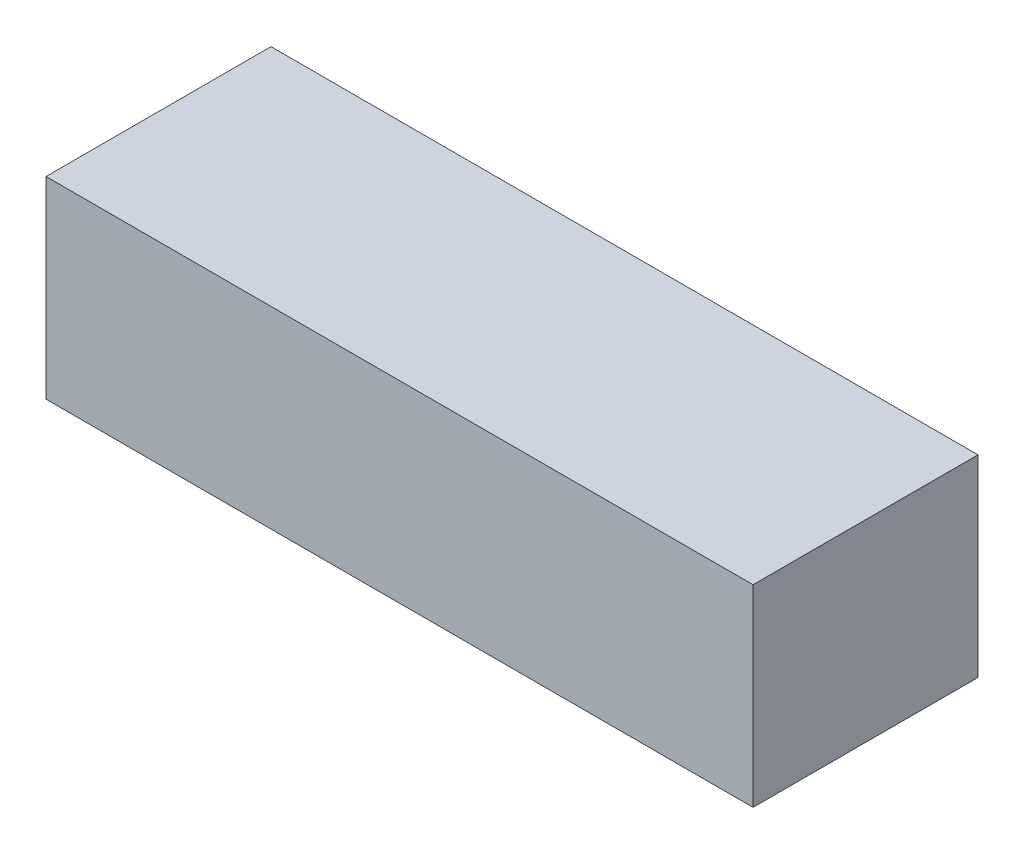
SolidWorks part; units mm, degrees
ref_plane "Front Plane" through (0, 0, 0) normal (0, 0, 1) x (1, 0, 0)
ref_plane "Top Plane" through (0, 0, 0) normal (0, 1, 0) x (1, 0, 0)
ref_plane "Right Plane" through (0, 0, 0) normal (1, 0, 0) x (0, 0, -1)
sketch "Sketch1" plane through (0, 0, 0) normal (0, 1, 0) x (1, 0, 0)
  line L1 (69.85, -22.225) -> (-69.85, -22.225)
  line L2 (69.85, -22.225) -> (69.85, 22.225)
  line L3 (69.85, 22.225) -> (-69.85, 22.225)
  line L4 (-69.85, -22.225) -> (-69.85, 22.225)
  line L5 (69.85, -22.225) -> (-69.85, 22.225) construction
  line L6 (69.85, 22.225) -> (-69.85, -22.225) construction
  point P0 (0, 0)
  dimension "D1" = 139.7
  dimension "D2" = 44.45
extrude "Boss-Extrude1" add sketch "Sketch1" along normal blind 38.1
equation "\"1.5n\"=1.75"
